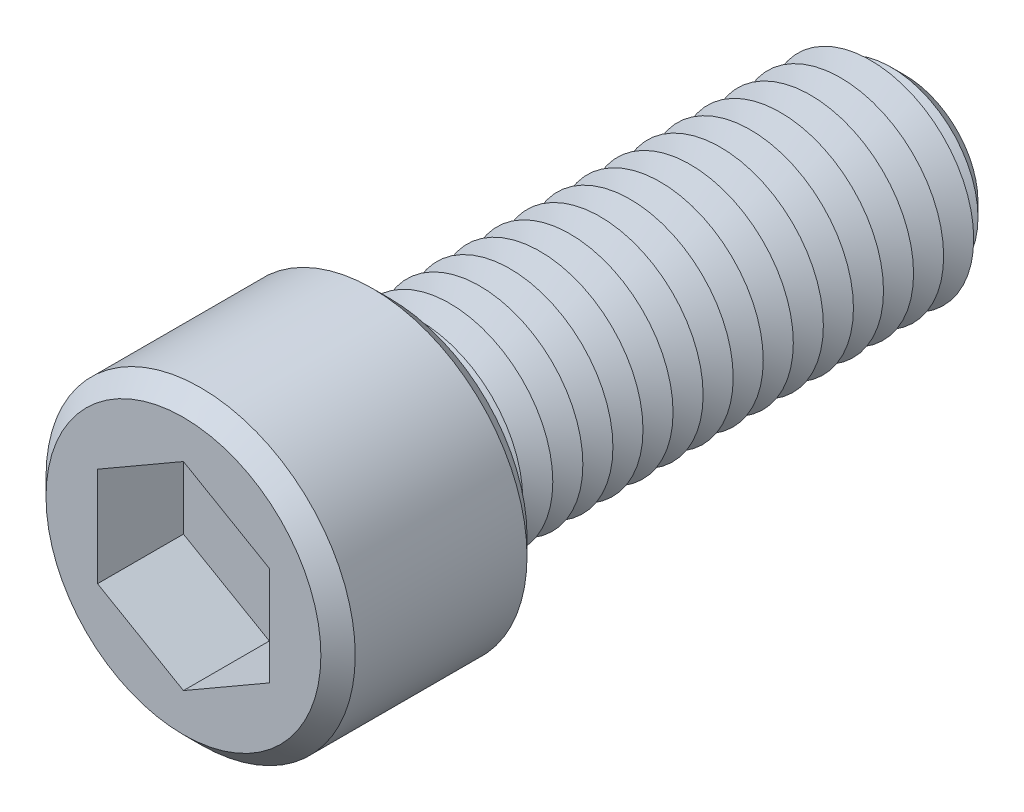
SolidWorks part; units mm, degrees
ref_plane "Front Plane" through (0, 0, 0) normal (0, 0, 1) x (1, 0, 0)
ref_plane "Top Plane" through (0, 0, 0) normal (0, 1, 0) x (1, 0, 0)
ref_plane "Right Plane" through (0, 0, 0) normal (1, 0, 0) x (0, 0, -1)
sketch "Sketch1" plane through (0, 0, 0) normal (0, 0, 1) x (1, 0, 0)
  circle A0 centre (0, 0) radius 9
  dimension "D1" = 18
extrude "Boss-Extrude1" add sketch "Sketch1" along normal blind 12
sketch "Sketch2" plane through (0, 0, 0) normal (0, 0, -1) x (-1, 0, 0)
  circle A0 centre (0, 0) radius 6
  dimension "D1" = 12
extrude "Boss-Extrude2" add sketch "Sketch2" along normal blind 30
chamfer "Chamfer1" distance 1.75 angle 45 1 edges at (-6, 0, -30)
sketch "Sketch3" plane through (0, 0, 0) normal (1, 0, 0) x (0, 0, -1)
  line L0 (-2.5121, 0) -> (4.5776, 0) construction
sketch "Sketch4" plane through (0, 0, 0) normal (1, 0, 0) x (0, 0, -1)
  line L0 (0, 6) -> (0.875, 4.4845)
  line L1 (0.875, 4.4845) -> (1.75, 6)
  line L2 (28.25, 6) -> (0, 6) construction
  line L3 (1.75, 6) -> (0, 6)
  dimension "D1" = 1.75
revolve "Cut-Revolve1" cut sketch "Sketch4" angle 360 about L0
pattern_linear "LPattern1" count 17 spacing 1.75 along (0, 0, -1) of "Cut-Revolve1"
sketch "Sketch5" plane through (0, 0, 12) normal (0, 0, 1) x (1, 0, 0)
  line L1 (0, 5.7735) -> (-5, 2.8868)
  line L2 (-5, 2.8868) -> (-5, -2.8868)
  line L3 (-5, -2.8868) -> (0, -5.7735)
  line L4 (0, -5.7735) -> (5, -2.8868)
  line L5 (5, -2.8868) -> (5, 2.8868)
  line L6 (5, 2.8868) -> (0, 5.7735)
  circle A0 centre (0, 0) radius 5 construction
  dimension "D1" = 10
extrude "Cut-Extrude1" cut sketch "Sketch5" against normal blind 5
sketch "Sketch6" plane through (0, 0, 7) normal (0, 0, 1) x (1, 0, 0)
  circle A0 centre (0, 0) radius 0.9
  dimension "D1" = 1.8
extrude "Cut-Extrude2" cut sketch "Sketch6" against normal up to surface (37 mm away)
chamfer "Chamfer2" distance 1 angle 45 2 edges at (9, 0, 0) (9, 0, 12)
